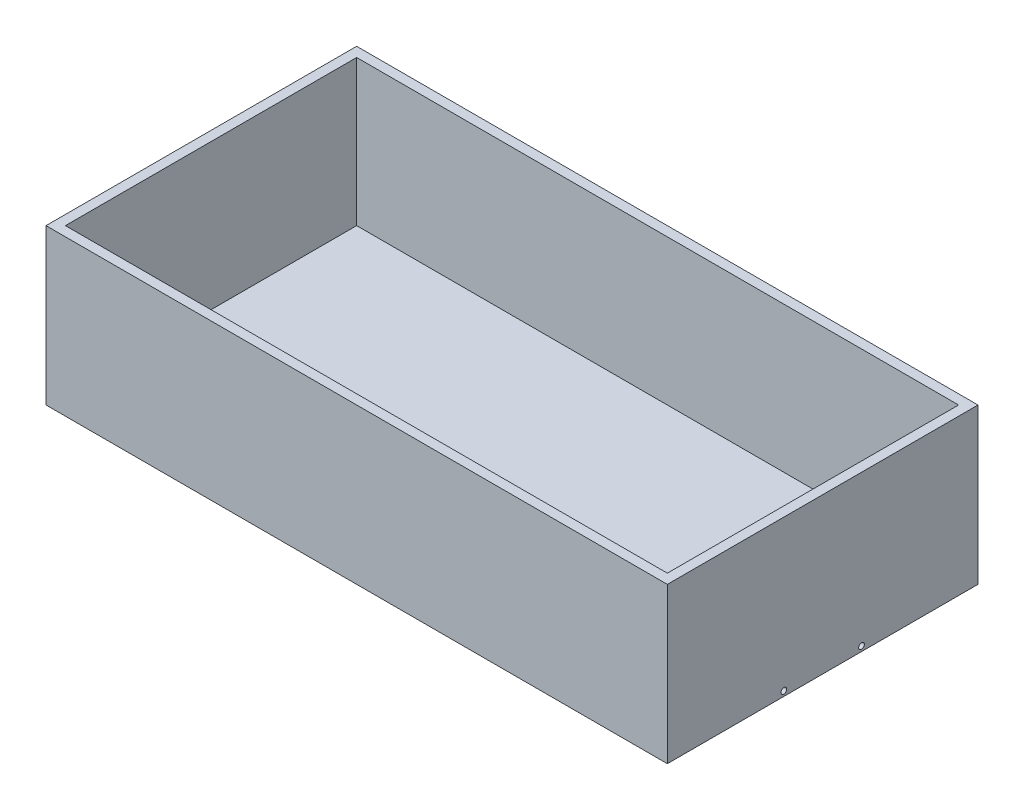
SolidWorks part; units mm, degrees
ref_plane "Front Plane" through (0, 0, 0) normal (0, 0, 1) x (1, 0, 0)
ref_plane "Top Plane" through (0, 0, 0) normal (0, 1, 0) x (1, 0, 0)
ref_plane "Right Plane" through (0, 0, 0) normal (1, 0, 0) x (0, 0, -1)
sketch "Sketch1" plane through (0, 0, 0) normal (0, 1, 0) x (1, 0, 0)
  line L1 (-101.6, -50.8) -> (101.6, -50.8)
  line L2 (-101.6, -50.8) -> (-101.6, 50.8)
  line L3 (-101.6, 50.8) -> (101.6, 50.8)
  line L4 (101.6, -50.8) -> (101.6, 50.8)
  line L5 (-101.6, -50.8) -> (101.6, 50.8) construction
  line L6 (-101.6, 50.8) -> (101.6, -50.8) construction
  point P0 (0, 0)
  dimension "D1" = 203.2
  dimension "D2" = 101.6
extrude "Boss-Extrude2" add sketch "Sketch1" along normal blind 50.8
sketch "Sketch2" plane through (0, 50.8, 0) normal (0, 1, 0) x (1, 0, 0)
  line L0 (101.6, 50.8) -> (-101.6, 50.8) construction
  line L1 (-98.425, -47.625) -> (98.425, -47.625)
  line L2 (-98.425, -47.625) -> (-98.425, 47.625)
  line L3 (-98.425, 47.625) -> (98.425, 47.625)
  line L4 (98.425, -47.625) -> (98.425, 47.625)
  line L5 (-98.425, -47.625) -> (98.425, 47.625) construction
  line L6 (-98.425, 47.625) -> (98.425, -47.625) construction
  line L7 (101.6, -50.8) -> (101.6, 50.8) construction
  point P0 (0, 0)
  dimension "D1" = 3.175
  dimension "D2" = 3.175
extrude "Cut-Extrude1" cut sketch "Sketch2" against normal blind 47.625
sketch "Sketch3" plane through (-101.6, 0, 0) normal (-1, 0, 0) x (0, 0, 1)
  line L0 (-0.0039, 1.5875) -> (12.6961, 1.5875) construction
  line L3 (-0.0039, 1.5875) -> (-12.7039, 1.5875) construction
  line L4 (-50.8, 0) -> (50.8, 0) construction
  dimension "D1" = 1.5875
  dimension "D2" = 12.7
  dimension "D3" = 25.4
hole_wizard "#1-64 Tapped Hole1" positions "Sketch5" profile "Sketch6" tap size "#1-64" standard "ANSI Inch"
sketch "Sketch5" plane through (-101.6, 0, 0) normal (-1, 0, 0) x (0, 0, 1)
  point P0 (-12.7039, 1.5875)
  point P3 (12.6961, 1.5875)
sketch "Sketch6" plane through (-101.6, 1.5875, -12.7039) normal (0, 1, 0) x (0, 0, 1)
  line L0 (0, 0) -> (0, 5.534)
  line L1 (0, 5.534) -> (0.7556, 5.08)
  line L2 (0.7556, 5.08) -> (0.7556, 3.81)
  line L3 (0.7556, 3.81) -> (0.9271, 3.81)
  line L4 (0.9271, 3.81) -> (0.9271, 0)
  line L5 (0.9271, 0) -> (0, 0)
  line L10 (0, 5.534) -> (-0.7557, 5.08) construction
  line L11 (0, -6.35) -> (0, 107.95) construction
  dimension "Tap Drill Dia." = 1.5113
  dimension "Tap Drill Depth" = 5.08
  dimension "Thread Major Dia." = 1.8542
  dimension "Thread Depth" = 3.81
  dimension "Drill Angle" = 118
mirror "Mirror1" about plane through (0, 0, 0) normal (1, 0, 0) of "#1-64 Tapped Hole1"
